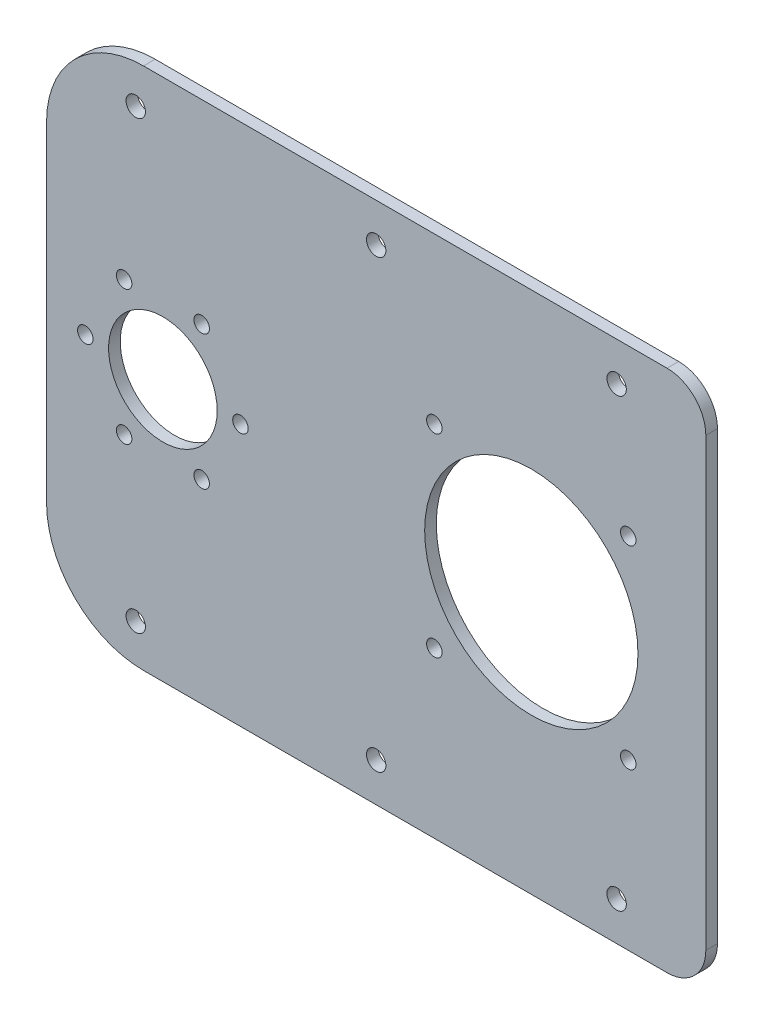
SolidWorks part; units mm, degrees
ref_plane "前视基准面" through (0, 0, 0) normal (0, 0, 1) x (1, 0, 0)
ref_plane "上视基准面" through (0, 0, 0) normal (0, 1, 0) x (1, 0, 0)
ref_plane "右视基准面" through (0, 0, 0) normal (1, 0, 0) x (0, 0, -1)
sketch "草图1" plane through (0, 0, 0) normal (0, 0, 1) x (1, 0, 0)
  line L0 (-55, 0) -> (0, 0) construction
  line L1 (-85, -67.5) -> (85, -67.5)
  line L2 (-85, -67.5) -> (-85, 67.5)
  line L3 (-85, 67.5) -> (85, 67.5)
  line L4 (85, -67.5) -> (85, 67.5)
  line L5 (-85, -67.5) -> (85, 67.5) construction
  line L6 (-85, 67.5) -> (85, -67.5) construction
  circle A0 centre (-55, 0) radius 14
  point P0 (0, 0)
  dimension "D4" = 28
  dimension "D3" = 30
  dimension "D1" = 170
  dimension "D2" = 135
extrude "凸台-拉伸1" add sketch "草图1" along normal mid plane 3
sketch "草图2" plane through (0, 0, 0) normal (0, 0, 1) x (1, 0, 0)
  line L0 (-85, 67.5) -> (-85, -67.5) construction
  line L2 (40, 0) -> (85, 0) construction
  line L3 (85, -67.5) -> (85, 67.5) construction
  circle A0 centre (40, 0) radius 27.5
  dimension "D1" = 55
  dimension "D2" = 125
extrude "切除-拉伸1" cut sketch "草图2" against normal through all both and the other way through all
sketch "草图3" plane through (0, 0, 1.5) normal (0, 0, 1) x (1, 0, 0)
  line L1 (15, -25) -> (65, -25) construction
  line L2 (15, -25) -> (15, 25) construction
  line L3 (15, 25) -> (65, 25) construction
  line L4 (65, -25) -> (65, 25) construction
  line L5 (15, -25) -> (65, 25) construction
  line L6 (15, 25) -> (65, -25) construction
  point P0 (40, 0)
  dimension "D1" = 50
hole_wizard "大小mm 暗销孔1" positions "3D草图1" profile "草图4" hole size "Ø4.0" standard "GB"
sketch3d "3D草图1"
  point P0 (15, 25, 1.5)
  point P3 (65, 25, 1.5)
  point P6 (15, -25, 1.5)
  point P9 (65, -25, 1.5)
sketch "草图4" plane through (15, 25, 1.5) normal (1, 0, 0) x (0, -1, 0)
  line L0 (0, 0) -> (0, 7.7017)
  line L1 (0, 7.7017) -> (2, 6.5)
  line L2 (2, 6.5) -> (2, 0)
  line L5 (2, 0) -> (0, 0)
  line L10 (0, 7.7017) -> (-2, 6.5) construction
  line L11 (0, -6.35) -> (0, 107.95) construction
  dimension "孔直径" = 4
  dimension "孔深度" = 6.5
  dimension "导头角度" = 118
sketch "yaw回转范围" plane through (0, 0, 1.5) normal (0, 0, 1) x (1, 0, 0)
  circle A0 centre (40, 0) radius 55
  dimension "D1" = 110
sketch "草图5" plane through (0, 0, 1.5) normal (0, 0, 1) x (1, 0, 0)
  line L0 (149.2261, 0) -> (-150.7739, 0) construction
  line L1 (85, -67.5) -> (85, 67.5) construction
  line L2 (85, 67.5) -> (-85, 67.5) construction
  line L3 (-85, 67.5) -> (-85, -67.5) construction
  circle A0 centre (62, 57.5) radius 2.5
  circle A1 centre (0, 57.5) radius 2.5
  circle A2 centre (-62, 57.5) radius 2.5
  circle A3 centre (-62, -57.5) radius 2.5
  circle A4 centre (0, -57.5) radius 2.5
  circle A5 centre (62, -57.5) radius 2.5
  circle A6 centre (-75, 0) radius 2
  circle A7 centre (-35, 0) radius 2
  circle A8 centre (-65, -17.3205) radius 2
  circle A9 centre (40, 0) radius 27.5 construction
  circle A10 centre (-55, 0) radius 20 construction
  circle A11 centre (-45, 17.3205) radius 2
  circle A12 centre (-45, -17.3205) radius 2
  circle A13 centre (-65, 17.3205) radius 2
  point P17 (0, 67.5)
  point P33 (-55, 0)
  point P41 (-55, 0)
  dimension "D1" = 5
  dimension "D2" = 5
  dimension "D3" = 5
  dimension "D4" = 23
  dimension "D5" = 10
  dimension "D6" = 23
  dimension "D7" = 4
  dimension "D8" = 95
  dimension "D9" = 40
  dimension "D12" = 4
  dimension "D11" = 20
  dimension "D10" = 3
  dimension "D13" = 3
extrude "切除-拉伸2" cut sketch "草图5" against normal through all
fillet "圆角1" radius 10 2 edges at (85, 67.5, 0) (85, -67.5, 0)
fillet "圆角2" radius 25 2 edges at (-85, -67.5, 0) (-85, 67.5, 0)
